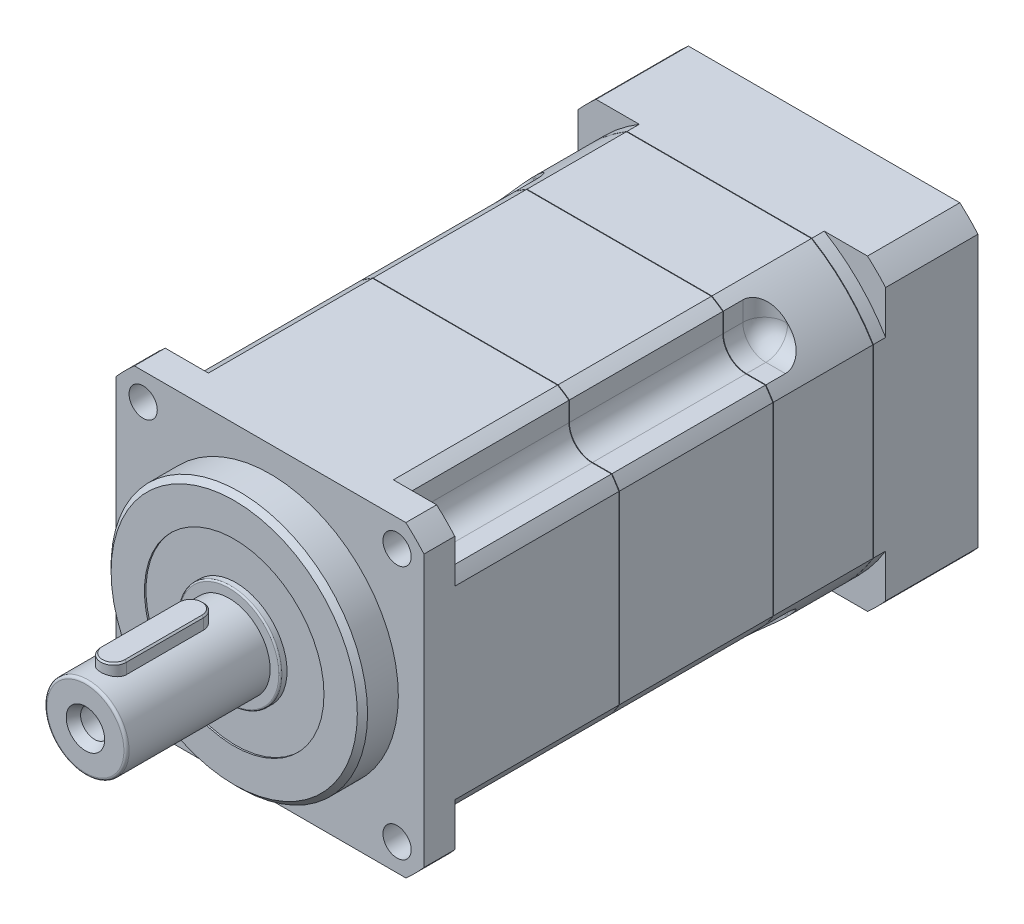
SolidWorks part; units mm, degrees
ref_plane "前视基准面" through (0, 0, 0) normal (0, 0, 1) x (1, 0, 0)
ref_plane "上视基准面" through (0, 0, 0) normal (0, 1, 0) x (1, 0, 0)
ref_plane "右视基准面" through (0, 0, 0) normal (1, 0, 0) x (0, 0, -1)
sketch "草图1" plane through (0, 0, 0) normal (0, 0, 1) x (1, 0, 0)
  line L1 (-26.4575, 30) -> (26.4575, 30)
  line L2 (-30, 26.4575) -> (-30, -26.4575)
  line L3 (-26.4575, -30) -> (26.4575, -30)
  line L4 (30, 26.4575) -> (30, -26.4575)
  arc A0 (-26.4575, 30) -> (-30, 26.4575) centre (0, 0) ccw
  arc A1 (-30, -26.4575) -> (-26.4575, -30) centre (0, 0) ccw
  arc A2 (26.4575, -30) -> (30, -26.4575) centre (0, 0) ccw
  arc A3 (30, 26.4575) -> (26.4575, 30) centre (0, 0) ccw
  dimension "D1" = 30
  dimension "D4" = 30
extrude "凸台-拉伸1" add sketch "草图1" along normal blind 6
sketch "草图2" plane through (0, 0, 6) normal (0, 0, 1) x (1, 0, 0)
  circle A0 centre (0, 0) radius 25
extrude "凸台-拉伸2" add sketch "草图2" along normal blind 7
sketch "草图3" plane through (0, 0, 0) normal (0, 0, -1) x (-1, 0, 0)
  line L1 (-18.0278, 30) -> (18.0278, 30)
  line L2 (-30, 18.0278) -> (-30, -18.0278)
  line L3 (-18.0278, -30) -> (18.0278, -30)
  line L4 (30, 18.0278) -> (30, -18.0278)
  arc A0 (-18.0278, 30) -> (-30, 18.0278) centre (0, 0) ccw
  arc A1 (-30, -18.0278) -> (-18.0278, -30) centre (0, 0) ccw
  arc A2 (18.0278, -30) -> (30, -18.0278) centre (0, 0) ccw
  arc A3 (30, 18.0278) -> (18.0278, 30) centre (0, 0) ccw
  dimension "D1" = 30
  dimension "D3" = 30
extrude "凸台-拉伸3" add sketch "草图3" along normal blind 32
sketch "草图4" plane through (0, 0, -32) normal (0, 0, -1) x (-1, 0, 0)
  line L1 (-34.1586, 33.3913) -> (-20.25, 33.3913)
  line L2 (-34.1586, 33.3913) -> (-34.1586, 20.25)
  line L3 (-34.1586, 20.25) -> (-20.25, 20.25)
  line L4 (-20.25, 33.3913) -> (-20.25, 20.25)
  dimension "D1" = 20.25
  dimension "D2" = 20.25
extrude "切除-拉伸1" cut sketch "草图4" against normal up to surface (32 mm away)
pattern_circular "阵列(圆周)1" count 4 over 360 about axis through (0, 0, 0) along (0, 0, 1) of "切除-拉伸1"
fillet "圆角1" radius 4.5 4 edges at (20.25, -20.25, -16) (-20.25, -20.25, -16) (-20.25, 20.25, -16) (20.25, 20.25, -16)
sketch "草图5" plane through (0, 0, 6) normal (0, 0, 1) x (1, 0, 0)
  line L0 (0, 0) -> (-28.2843, 28.2843) construction
  circle A0 centre (0, 0) radius 35 construction
  arc A1 (-26.4575, 30) -> (-30, 26.4575) centre (0, 0) ccw construction
  circle A2 centre (-24.7487, 24.7487) radius 2.75
extrude "切除-拉伸2" cut sketch "草图5" against normal blind 32
pattern_circular "阵列(圆周)2" count 4 over 360 about axis through (0, 0, 0) along (0, 0, 1) of "切除-拉伸2"
ref_plane "基准面1" through (0, 0, -32.1) normal (0, 0, -1) x (-1, 0, 0)
sketch "草图6" plane through (0, 0, -32.1) normal (0, 0, -1) x (-1, 0, 0)
  line L1 (-18.0278, 30) -> (18.0278, 30)
  line L2 (-30, 18.0278) -> (-30, -18.0278)
  line L3 (-18.0278, -30) -> (18.0278, -30)
  line L4 (30, 18.0278) -> (30, -18.0278)
  arc A0 (-18.0278, 30) -> (-30, 18.0278) centre (0, 0) ccw
  arc A1 (-30, -18.0278) -> (-18.0278, -30) centre (0, 0) ccw
  arc A2 (18.0278, -30) -> (30, -18.0278) centre (0, 0) ccw
  arc A3 (30, 18.0278) -> (18.0278, 30) centre (0, 0) ccw
  dimension "D1" = 30
  dimension "D3" = 30
extrude "凸台-拉伸4" add sketch "草图6" along normal blind 29.9 separate body
sketch "草图7" plane through (0, 0, -32.1) normal (0, 0, 1) x (1, 0, 0)
  line L1 (-36.173, 34.5423) -> (-20.25, 34.5423)
  line L2 (-36.173, 34.5423) -> (-36.173, 20.25)
  line L3 (-36.173, 20.25) -> (-20.25, 20.25)
  line L4 (-20.25, 34.5423) -> (-20.25, 20.25)
  dimension "D1" = 20.25
  dimension "D2" = 20.25
extrude "切除-拉伸3" cut sketch "草图7" against normal up to surface (29.9 mm away)
pattern_circular "阵列(圆周)3" count 4 over 360 about axis through (0, 0, 0) along (0, 0, 1) of "切除-拉伸3"
fillet "圆角2" radius 4.5 4 edges at (-20.25, -20.25, -47.05) (20.25, -20.25, -47.05) (20.25, 20.25, -47.05) (-20.25, 20.25, -47.05)
chamfer "倒角1" distance 1 angle 45 1 edges at (25, 0, 13)
ref_plane "基准面2" through (0, 0, -62.1) normal (0, 0, -1) x (-1, 0, 0)
sketch "草图8" plane through (0, 0, -62.1) normal (0, 0, -1) x (-1, 0, 0)
  line L1 (-18.0278, 30) -> (18.0278, 30)
  line L2 (-30, 18.0278) -> (-30, -18.0278)
  line L3 (-18.0278, -30) -> (18.0278, -30)
  line L4 (30, 18.0278) -> (30, -18.0278)
  arc A0 (-18.0278, 30) -> (-30, 18.0278) centre (0, 0) ccw
  arc A1 (-30, -18.0278) -> (-18.0278, -30) centre (0, 0) ccw
  arc A2 (18.0278, -30) -> (30, -18.0278) centre (0, 0) ccw
  arc A3 (30, 18.0278) -> (18.0278, 30) centre (0, 0) ccw
  dimension "D1" = 30
  dimension "D2" = 30
  dimension "D3" = 30
extrude "凸台-拉伸5" add sketch "草图8" along normal blind 19.4 separate body
sketch "草图9" plane through (0, 0, -62.1) normal (0, 0, 1) x (1, 0, 0)
  line L1 (-30.432, 32.3532) -> (-20.25, 32.3532)
  line L2 (-30.432, 32.3532) -> (-30.432, 20.25)
  line L3 (-30.432, 20.25) -> (-20.25, 20.25)
  line L4 (-20.25, 32.3532) -> (-20.25, 20.25)
  dimension "D1" = 20.25
  dimension "D2" = 20.25
extrude "切除-拉伸4" cut sketch "草图9" against normal blind 8
pattern_circular "阵列(圆周)4" count 4 over 360 about axis through (0, 0, 0) along (0, 0, 1) of "切除-拉伸4"
fillet "圆角3" radius 4.5 4 edges at (-20.25, -20.25, -66.1) (20.25, -20.25, -66.1) (20.25, 20.25, -66.1) (-20.25, 20.25, -66.1)
fillet "圆角4" radius 4.2 12 edges at (26.6486, -20.25, -70.1) (20.25, -26.6486, -70.1) (20.25, 26.6486, -70.1) (26.6486, 20.25, -70.1) (-26.6486, 20.25, -70.1) (-20.25, 26.6486, -70.1) (-20.25, -26.6486, -70.1) (-26.6486, -20.25, -70.1) (21.568, -21.568, -70.1) (21.568, 21.568, -70.1) (-21.568, 21.568, -70.1) (-21.568, -21.568, -70.1)
ref_plane "基准面3" through (0, 0, -81.6) normal (0, 0, -1) x (-1, 0, 0)
sketch "草图10" plane through (0, 0, -81.6) normal (0, 0, -1) x (-1, 0, 0)
  line L0 (18.0278, 30) -> (-18.0278, 30) construction
  line L1 (-30, 18.0278) -> (-30, -18.0278) construction
  line L2 (-18.0278, -30) -> (18.0278, -30) construction
  line L3 (30, -18.0278) -> (30, 18.0278) construction
  line L4 (18.0278, 30) -> (-18.0278, 30)
  line L5 (-30, 18.0278) -> (-30, -18.0278)
  line L6 (-18.0278, -30) -> (18.0278, -30)
  line L7 (30, -18.0278) -> (30, 18.0278)
  arc A0 (30, 18.0278) -> (18.0278, 30) centre (0, 0) ccw construction
  arc A1 (-18.0278, 30) -> (-30, 18.0278) centre (0, 0) ccw construction
  arc A2 (-30, -18.0278) -> (-18.0278, -30) centre (0, 0) ccw construction
  arc A3 (18.0278, -30) -> (30, -18.0278) centre (0, 0) ccw construction
  arc A4 (30, 18.0278) -> (18.0278, 30) centre (0, 0) ccw
  arc A5 (-18.0278, 30) -> (-30, 18.0278) centre (0, 0) ccw
  arc A6 (-30, -18.0278) -> (-18.0278, -30) centre (0, 0) ccw
  arc A7 (18.0278, -30) -> (30, -18.0278) centre (0, 0) ccw
extrude "凸台-拉伸6" add sketch "草图10" along normal blind 2.4 separate body
sketch "草图11" plane through (0, 0, -84) normal (0, 0, -1) x (-1, 0, 0)
  line L1 (-26.4575, 30) -> (26.4575, 30)
  line L2 (-30, 26.4575) -> (-30, -26.4575)
  line L3 (-26.4575, -30) -> (26.4575, -30)
  line L4 (30, 26.4575) -> (30, -26.4575)
  arc A0 (-26.4575, 30) -> (-30, 26.4575) centre (0, 0) ccw
  arc A1 (-30, -26.4575) -> (-26.4575, -30) centre (0, 0) ccw
  arc A2 (26.4575, -30) -> (30, -26.4575) centre (0, 0) ccw
  arc A3 (30, 26.4575) -> (26.4575, 30) centre (0, 0) ccw
  dimension "D1" = 30
  dimension "D3" = 30
extrude "凸台-拉伸7" add sketch "草图11" along normal blind 18
sketch "草图12" plane through (0, 0, -102) normal (0, 0, -1) x (-1, 0, 0)
  circle A0 centre (0, 0) radius 25
extrude "切除-拉伸5" cut sketch "草图12" against normal blind 5
sketch "草图13" plane through (0, 0, -102) normal (0, 0, -1) x (-1, 0, 0)
  line L0 (0, 0) -> (0, -25) construction
  line L1 (0, 0) -> (6.4705, -24.1481) construction
  circle A0 centre (0, 0) radius 25 construction
  circle A1 centre (6.4705, -24.1481) radius 4
  dimension "D1" = 15
extrude "切除-拉伸6" cut sketch "草图13" against normal blind 12
pattern_circular "阵列(圆周)5" count 4 over 360 about axis through (0, 0, 0) along (0, 0, 1) of "切除-拉伸6"
sketch "草图14" plane through (0, 0, -102) normal (0, 0, -1) x (-1, 0, 0)
  line L0 (0, 0) -> (-24.1481, -6.4705) construction
  line L1 (0, 0) -> (-15.733, -19.4286) construction
  arc A0 (-22.8071, -10.239) -> (2.5363, -24.871) centre (0, 0) ccw construction
  circle A1 centre (-15.733, -19.4286) radius 4
  dimension "D1" = 36
extrude "切除-拉伸7" cut sketch "草图14" against normal blind 12
pattern_circular "阵列(圆周)6" count 2 over 360 about axis through (0, 0, 0) along (0, 0, 1) of "切除-拉伸7"
sketch "草图15" plane through (0, 0, -102) normal (0, 0, -1) x (-1, 0, 0)
  line L0 (0, 0) -> (-24.7487, -24.7487) construction
  circle A0 centre (0, 0) radius 35 construction
hole_wizard "M4 螺纹孔1" positions "3D草图1" profile "草图16" tap size "M4" standard "GB"
sketch3d "3D草图1"
  point P0 (24.7487, -24.7487, -102)
sketch "草图16" plane through (24.7487, -24.7487, -102) normal (1, 0, 0) x (0, 1, 0)
  line L0 (0, 0) -> (0, 16.4914)
  line L1 (0, 16.4914) -> (1.65, 15.5)
  line L2 (1.65, 15.5) -> (1.65, 0)
  line L5 (1.65, 0) -> (0, 0)
  line L10 (0, 16.4914) -> (-1.65, 15.5) construction
  line L11 (0, -6.35) -> (0, 107.95) construction
  dimension "螺纹孔钻头直径" = 3.3
  dimension "螺纹孔钻头深度" = 15.5
  dimension "导头角度" = 118
pattern_circular "阵列(圆周)7" count 4 over 360 about axis through (0, 0, 0) along (0, 0, 1) of "M4 螺纹孔1"
sketch "草图17" plane through (0, 0, -97) normal (0, 0, -1) x (-1, 0, 0)
  circle A0 centre (0, 0) radius 19
extrude "切除-拉伸8" cut sketch "草图17" against normal blind 13
sketch "草图18" plane through (0, 0, -84) normal (0, 0, -1) x (-1, 0, 0)
  circle A0 centre (0, 0) radius 16.5
extrude "凸台-拉伸8" add sketch "草图18" along normal blind 11.5
chamfer "倒角2" distance 1 angle 45 1 edges at (-16.5, 0, -95.5)
sketch "草图19" plane through (0, 0, -90) normal (0, 0, -1) x (-1, 0, 0)
  line L1 (-5.4109, 26.0243) -> (-7.5655, 26.0039)
  line L2 (-7.5655, 26.0039) -> (-8.6251, 24.1277)
  line L3 (-8.6251, 24.1277) -> (-7.5301, 22.272)
  line L4 (-7.5301, 22.272) -> (-5.3755, 22.2924)
  line L5 (-5.3755, 22.2924) -> (-4.3158, 24.1686)
  line L6 (-4.3158, 24.1686) -> (-5.4109, 26.0243)
  circle A0 centre (-6.4705, 24.1481) radius 3
  circle A1 centre (-6.4705, 24.1481) radius 1.866 construction
extrude "凸台-拉伸9" add sketch "草图19" along normal blind 6
pattern_circular "阵列(圆周)8" count 4 over 360 about axis through (0, 0, 0) along (0, 0, 1) of "凸台-拉伸9"
sketch "草图20" plane through (0, 0, -90) normal (0, 0, -1) x (-1, 0, 0)
  line L1 (-14.8583, -17.801) -> (-16.7053, -17.8573)
  line L2 (-16.7053, -17.8573) -> (-17.58, -19.485)
  line L3 (-17.58, -19.485) -> (-16.6077, -21.0563)
  line L4 (-16.6077, -21.0563) -> (-14.7607, -21)
  line L5 (-14.7607, -21) -> (-13.8861, -19.3723)
  line L6 (-13.8861, -19.3723) -> (-14.8583, -17.801)
  circle A0 centre (-15.733, -19.4286) radius 3
  circle A1 centre (-15.733, -19.4286) radius 1.6002 construction
extrude "凸台-拉伸10" add sketch "草图20" along normal blind 6
pattern_circular "阵列(圆周)9" count 2 over 360 about axis through (0, 0, 0) along (0, 0, 1) of "凸台-拉伸10"
sketch "草图21" plane through (0, 0, -102) normal (0, 0, -1) x (-1, 0, 0)
  circle A0 centre (0, 0) radius 7
extrude "切除-拉伸9" cut sketch "草图21" against normal blind 34
sketch "草图22" plane through (0, 0, -95.5) normal (0, 0, -1) x (-1, 0, 0)
  line L1 (-17.6586, 0.5) -> (18.0751, 0.5)
  line L2 (-17.6586, 0.5) -> (-17.6586, -0.5)
  line L3 (-17.6586, -0.5) -> (18.0751, -0.5)
  line L4 (18.0751, 0.5) -> (18.0751, -0.5)
  dimension "D1" = 0.5
  dimension "D2" = 1
extrude "切除-拉伸10" cut sketch "草图22" against normal up to surface (11.5 mm away)
sketch "草图23" plane through (0, 0, 13) normal (0, 0, 1) x (1, 0, 0)
  circle A0 centre (0, 0) radius 8
extrude "凸台-拉伸11" add sketch "草图23" along normal blind 29
fillet "圆角5" radius 0.5 1 edges at (8, 0, 42)
sketch "草图24" plane through (0, 0, 13) normal (0, 0, 1) x (1, 0, 0)
  circle A0 centre (0, 0) radius 17.5
  circle A1 centre (0, 0) radius 8
extrude "切除-拉伸11" cut sketch "草图24" against normal blind 0.3
sketch "草图25" plane through (0, 0, 0) normal (0, 1, 0) x (1, 0, 0)
  line L0 (-7.5, -42) -> (7.5, -42) construction
  line L1 (-2.5, -36.5) -> (-2.5, -21.5)
  line L2 (2.5, -36.5) -> (2.5, -21.5)
  arc A0 (-2.5, -36.5) -> (2.5, -36.5) centre (0, -36.5) ccw
  arc A1 (2.5, -21.5) -> (-2.5, -21.5) centre (0, -21.5) ccw
  dimension "D1" = 15
  dimension "D2" = 5.5
extrude "凸台-拉伸12" add sketch "草图25" along normal blind 10
chamfer "倒角3" distance 0.3 angle 45 4 edges at (-2.5, 10, 29) (0, 10, 39) (0, 10, 19) (2.5, 10, 29)
sketch "草图26" plane through (0, 0, 42) normal (0, 0, 1) x (1, 0, 0)
  circle A0 centre (0, 0) radius 2.75
extrude "切除-拉伸12" cut sketch "草图26" against normal blind 4.8
ref_plane "基准面4" through (0, 0, 40.2) normal (0, 0, 1) x (1, 0, 0)
sketch "草图27" plane through (0, 0, 42) normal (0, 0, 1) x (1, 0, 0)
  circle A0 centre (0, 0) radius 3.75
sketch "草图28" plane through (0, 0, 40.2) normal (0, 0, 1) x (1, 0, 0)
  circle A0 centre (0, 0) radius 2.75 construction
  circle A1 centre (0, 0) radius 2.75
loft "切除-放样1" cut profiles "草图27", "草图28"
hole_wizard "M5 螺纹孔1" positions "3D草图2" profile "草图29" tap size "M5" standard "GB"
sketch3d "3D草图2"
  line L0 (0, 0, 37.2) -> (0, 0, 40.2) construction
  point P0 (0, 0, 37.2)
sketch "草图29" plane through (0, 0, 37.2) normal (1, 0, 0) x (0, -1, 0)
  line L0 (0, 0) -> (0, 20.4618)
  line L1 (0, 20.4618) -> (2.1, 19.2)
  line L2 (2.1, 19.2) -> (2.1, 0)
  line L5 (2.1, 0) -> (0, 0)
  line L10 (0, 20.4618) -> (-2.1, 19.2) construction
  line L11 (0, -6.35) -> (0, 107.95) construction
  dimension "螺纹孔钻头直径" = 4.2
  dimension "螺纹孔钻头深度" = 19.2
  dimension "导头角度" = 118
sketch "草图30" plane through (0, 0, 12.7) normal (0, 0, 1) x (1, 0, 0)
  circle A0 centre (0, 0) radius 10
  circle A1 centre (0, 0) radius 8
extrude "凸台-拉伸13" add sketch "草图30" along normal blind 1.3
fillet "圆角6" radius 0.3 1 edges at (10, 0, 14)
